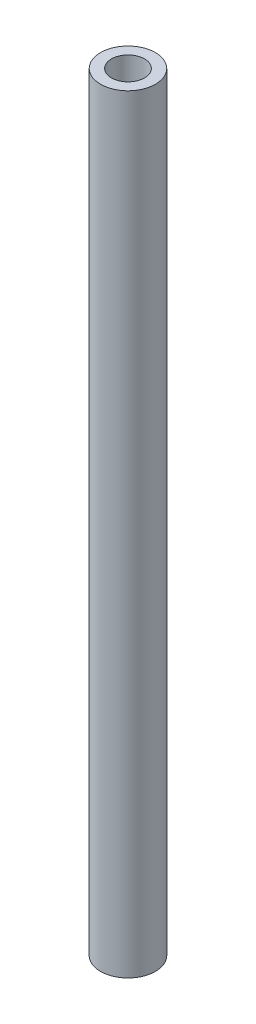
SolidWorks part; units mm, degrees
ref_plane "Front Plane" through (0, 0, 0) normal (0, 0, 1) x (1, 0, 0)
ref_plane "Top Plane" through (0, 0, 0) normal (0, 1, 0) x (1, 0, 0)
ref_plane "Right Plane" through (0, 0, 0) normal (1, 0, 0) x (0, 0, -1)
sketch "Sketch1" plane through (0, 0, 0) normal (0, 1, 0) x (1, 0, 0)
  circle A0 centre (0, 0) radius 3.175
  circle A1 centre (0, 0) radius 1.9126
  dimension "D1" = 6.35
extrude "Boss-Extrude1" add sketch "Sketch1" along normal blind 88.9
